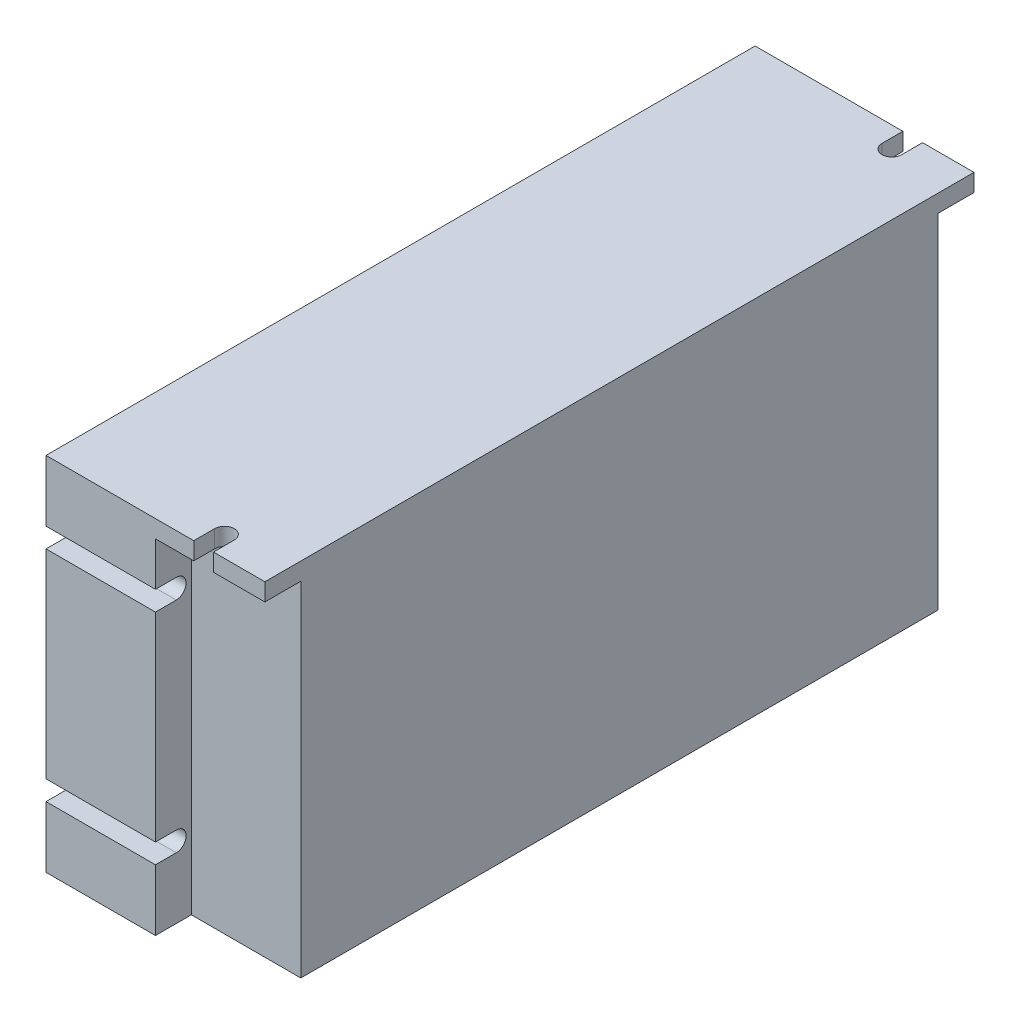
SolidWorks part; units mm, degrees
ref_plane "前视基准面" through (0, 0, 0) normal (0, 0, 1) x (1, 0, 0)
ref_plane "上视基准面" through (0, 0, 0) normal (0, 1, 0) x (1, 0, 0)
ref_plane "右视基准面" through (0, 0, 0) normal (1, 0, 0) x (0, 0, -1)
sketch "草图1" plane through (0, 0, 0) normal (1, 0, 0) x (0, 0, -1)
  line L1 (-81, -41.25) -> (81, -41.25)
  line L2 (-81, -41.25) -> (-81, 41.25)
  line L3 (-81, 41.25) -> (81, 41.25)
  line L4 (81, -41.25) -> (81, 41.25)
  line L5 (-81, -41.25) -> (81, 41.25) construction
  line L6 (-81, 41.25) -> (81, -41.25) construction
  point P0 (0, 0)
extrude "凸台-拉伸1" add sketch "草图1" along normal blind 50
sketch "草图2" plane through (50, 0, 0) normal (1, 0, 0) x (0, 0, -1)
  line L1 (-81, 41.25) -> (-81, -41.25) construction
  line L2 (-81, 37.25) -> (-72.8, 37.25)
  line L3 (-72.8, 37.25) -> (-72.8, -41.25)
  line L4 (-81, -41.25) -> (81, -41.25) construction
  line L5 (-72.8, -41.25) -> (-81, -41.25)
  line L6 (-81, -41.25) -> (-81, 37.25)
  line L7 (81, 37.25) -> (72.8, 37.25)
  line L8 (81, -41.25) -> (81, 41.25) construction
  line L9 (72.8, 37.25) -> (72.8, -41.25)
  line L10 (72.8, -41.25) -> (81, -41.25)
  line L11 (81, -41.25) -> (81, 37.25)
extrude "切除-拉伸1" cut sketch "草图2" against normal blind 25
sketch "草图3" plane through (25, 0, 0) normal (1, 0, 0) x (0, 0, -1)
  line L0 (-81, -41.25) -> (-81, -25)
  line L1 (-81, 37.25) -> (-81, -41.25) construction
  line L3 (-76.25, -27.25) -> (-81, -27.25)
  line L4 (-81, -27.25) -> (-81, -22.75)
  line L5 (-81, -22.75) -> (-76.25, -22.75)
  line L8 (-76.25, 22.75) -> (-81, 22.75)
  line L9 (-81, 22.75) -> (-81, 27.25)
  line L10 (-81, 27.25) -> (-76.25, 27.25)
  line L12 (81, -41.25) -> (81, 37.25) construction
  line L13 (76.25, -22.75) -> (81, -22.75)
  line L14 (81, -22.75) -> (81, -27.25)
  line L15 (81, -27.25) -> (76.25, -27.25)
  line L17 (76.25, 27.25) -> (81, 27.25)
  line L18 (81, 27.25) -> (81, 22.75)
  line L19 (81, 22.75) -> (76.25, 22.75)
  arc A0 (-76.25, -27.25) -> (-76.25, -22.75) centre (-76.25, -25) ccw
  arc A1 (-76.25, 22.75) -> (-76.25, 27.25) centre (-76.25, 25) ccw
  arc A2 (76.25, -22.75) -> (76.25, -27.25) centre (76.25, -25) ccw
  arc A3 (76.25, 27.25) -> (76.25, 22.75) centre (76.25, 25) ccw
extrude "切除-拉伸2" cut sketch "草图3" against normal blind 25 contours L5 A0 L3 L4 | L10 A1 L8 L9 | L13 L14 L15 A2 | L19 A3 L17 L18
sketch "草图4" plane through (0, 41.25, 0) normal (0, 1, 0) x (1, 0, 0)
  line L1 (50, 81) -> (0, 81) construction
  line L3 (33.75, 76.25) -> (33.75, 81)
  line L4 (33.75, 81) -> (38.25, 81)
  line L5 (38.25, 81) -> (38.25, 76.25)
  line L7 (50, -81) -> (0, -81) construction
  line L8 (33.75, -76.25) -> (33.75, -81)
  line L9 (33.75, -81) -> (38.25, -81)
  line L10 (38.25, -81) -> (38.25, -76.25)
  arc A0 (33.75, 76.25) -> (38.25, 76.25) centre (36, 76.25) ccw
  arc A1 (38.25, -76.25) -> (33.75, -76.25) centre (36, -76.25) ccw
extrude "切除-拉伸3" cut sketch "草图4" against normal blind 4
sketch "草图5" plane through (50, 0, 0) normal (1, 0, 0) x (0, 0, -1)
  text T0 "BLD-50" font "汉仪长仿宋体" height 6
